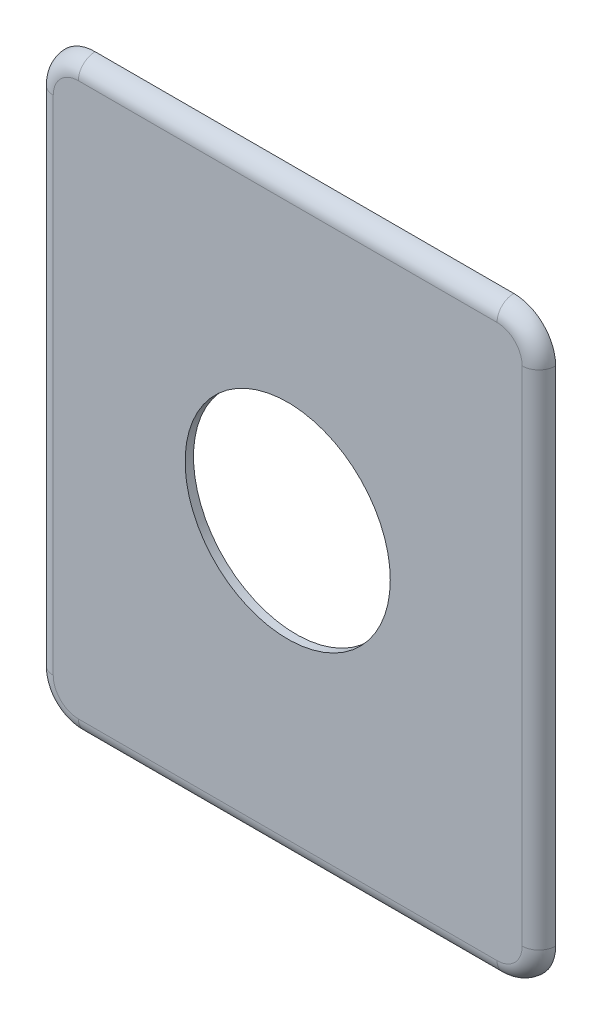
SolidWorks part; units mm, degrees
ref_plane "Спереди" through (0, 0, 0) normal (0, 0, 1) x (1, 0, 0)
ref_plane "Сверху" through (0, 0, 0) normal (0, 1, 0) x (1, 0, 0)
ref_plane "Справа" through (0, 0, 0) normal (1, 0, 0) x (0, 0, -1)
other "Configuration Table"
sketch "Эскиз1" plane through (0, 0, 0) normal (0, 0, 1) x (1, 0, 0)
  line L1 (-25, -35) -> (25, -35)
  line L2 (-30, -30) -> (-30, 30)
  line L3 (-25, 35) -> (25, 35)
  line L4 (30, -30) -> (30, 30)
  line L5 (-30, -35) -> (30, 35) construction
  line L6 (-30, 35) -> (30, -35) construction
  arc A0 (-25, -35) -> (-30, -30) centre (-25, -30) cw
  arc A1 (25, -35) -> (30, -30) centre (25, -30) ccw
  arc A2 (25, 35) -> (30, 30) centre (25, 30) cw
  arc A3 (-30, 30) -> (-25, 35) centre (-25, 30) cw
  point P0 (0, 0)
  dimension "D3" = 5
  dimension "D1" = 70
  dimension "D2" = 60
extrude "Бобышка-Вытянуть1" add sketch "Эскиз1" along normal blind 2
ref_plane "Плоскость1" through (0, 0, 0) normal (0, 1, 0) x (1, 0, 0)
sketch "Эскиз2" plane through (0, 0, 0) normal (0, 1, 0) x (1, 0, 0)
  line L0 (0, -2) -> (12.25, -2)
  line L1 (0, -2) -> (0, 0)
  line L2 (0, 0) -> (14.25, 0)
  line L3 (12.25, -2) -> (12.25, -1)
  line L4 (12.25, -1) -> (14.25, -1)
  line L5 (14.25, -1) -> (14.25, 0)
  line L6 (25, -2) -> (-25, -2) construction
  line L7 (25, 0) -> (-25, 0) construction
  point P6 (0, -2)
  dimension "D2" = 12.25
  dimension "D3" = 1
  dimension "D4" = 14.25
revolve "Вырез-Повернуть1" cut sketch "Эскиз2" angle 360 about L1
fillet "Скругление1" radius 2 8 edges at (-28.5355, 33.5355, 2) (0, 35, 2) (28.5355, 33.5355, 2) (30, 0, 2) (28.5355, -33.5355, 2) (0, -35, 2) (-28.5355, -33.5355, 2) (-30, 0, 2)
